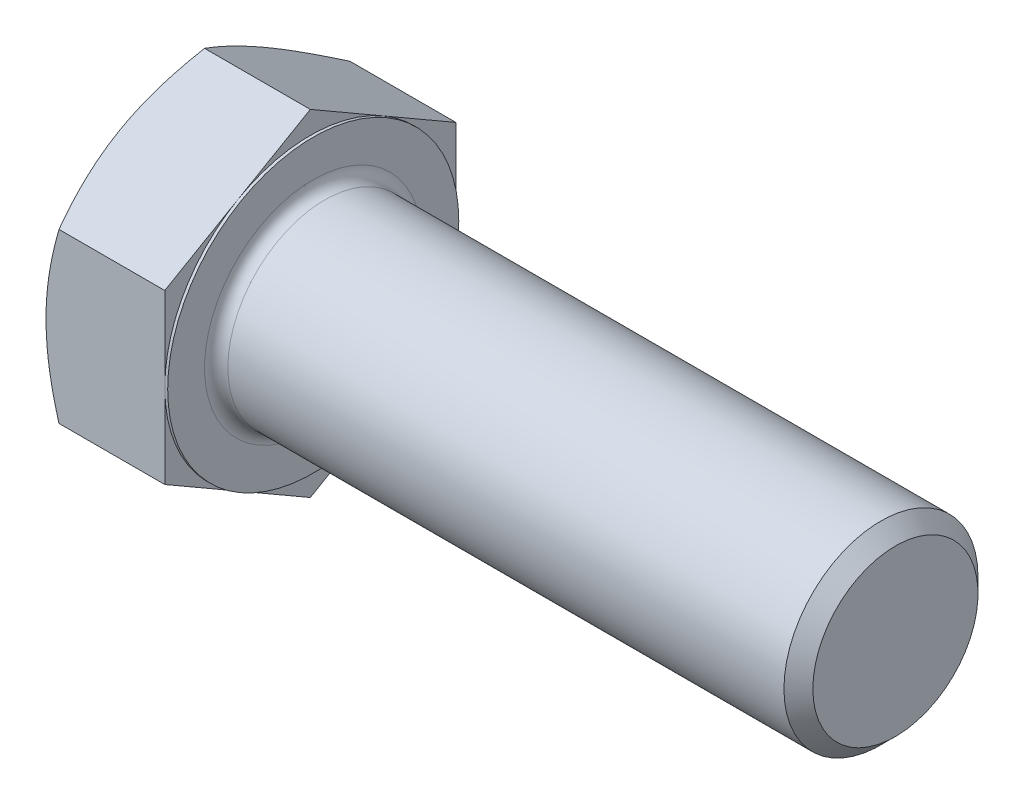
SolidWorks part; units mm, degrees
extrude "BaseHead" add sketch "Sketch1" along normal blind 15.9258
sketch "Sketch1" plane through (0, 0, 0) normal (1, 0, 0) x (0, 0, -1)
  line L0 (19.05, 10.9985) -> (19.05, -10.9985)
  line L1 (-19.05, 10.9985) -> (-19.05, -10.9985)
  line L2 (19.05, -10.9985) -> (0, -21.997)
  line L3 (0, -21.997) -> (-19.05, -10.9985)
  line L4 (19.05, 10.9985) -> (0, 21.997)
  line L5 (0, 21.997) -> (-19.05, 10.9985)
revolve "HeadChamfer" cut sketch "Sketch3" angle 360 about L6
sketch "Sketch3" plane through (0, 0, 0) normal (0, 0, 1) x (1, 0, 0)
  line L0 (0, 19.05) -> (5.3677, 28.347)
  line L1 (0, 21.997) -> (0, 10.9985) construction
  line L2 (5.3677, 28.347) -> (5.3677, 34.697)
  line L3 (5.3677, 34.697) -> (-12.7, 34.697)
  line L4 (-12.7, 34.697) -> (-12.7, 19.05)
  line L5 (-12.7, 19.05) -> (0, 19.05)
  line L6 (0, 0) -> (99.06, 0) construction
  line L7 (15.9258, 21.997) -> (0, 21.997) construction
ref_plane "Plane1" through (0, 0, 0) normal (0, 0, 1) x (1, 0, 0)
ref_plane "Plane2" through (0, 0, 0) normal (0, 1, 0) x (1, 0, 0)
ref_plane "Plane3" through (0, 0, 0) normal (1, 0, 0) x (0, 0, -1)
other "Configuration Table"
sketch "BodySke" plane through (0, 0, 0) normal (0, 0, 1) x (1, 0, 0)
  line L0 (0, 10.9985) -> (0, -10.9985) construction
  line L1 (0, 0) -> (92.1258, 0)
  line L2 (0, 0) -> (0, 12.7)
  line L3 (0, 12.7) -> (90.2335, 12.7)
  line L4 (92.1258, 0) -> (92.1258, 10.8077)
  line L5 (15.9258, 21.997) -> (15.9258, 10.9985) construction
  line L6 (92.1258, 10.8077) -> (90.2335, 12.7)
  line L7 (0, 0) -> (96.52, 0) construction
  line L8 (92.1258, -10.8077) -> (90.2335, -12.7) construction
  line L9 (0, -12.7) -> (90.2335, -12.7) construction
  line L10 (18.034, 15.24) -> (18.034, -1.27) construction
  line L11 (60.3758, 15.24) -> (60.3758, -1.27) construction
  line L12 (15.9258, 10.9985) -> (15.9258, -10.9985) construction
revolve "BaseBody" add sketch "BodySke" angle 360 about L7
sketch "Sketch4" plane through (0, 0, 0) normal (0, 0, 1) x (1, 0, 0)
  line L1 (15.9258, 21.997) -> (15.9258, 10.9985) construction
  line L2 (15.9258, 19.05) -> (15.5448, 19.05)
  line L3 (15.9258, 19.05) -> (15.9258, 47.397)
  line L4 (15.9258, 47.397) -> (15.5448, 47.397)
  line L5 (0, 0) -> (95.25, 0) construction
  line L6 (0, 0) -> (96.52, 0) construction
  line L7 (15.5448, 19.05) -> (15.5448, 47.397)
  line L8 (15.9258, 21.997) -> (1.7015, 21.997) construction
revolve "BearingFace" cut sketch "Sketch4" angle 360 about L5
fillet "HeadFillet" radius 1.524 1 edges at (15.9258, 0, -12.7)
sketch "ThdSchSke" plane through (0, 0, 0) normal (0, 0, 1) x (1, 0, 0)
  line L0 (60.3758, -10.8077) -> (59.0508, -12.7)
  line L1 (60.3758, -10.8077) -> (61.7008, -12.7)
  line L2 (61.7008, -12.7) -> (61.7008, -15.875)
  line L3 (-3.175, 0) -> (5.1513, 0) construction
  line L5 (61.7008, -15.875) -> (59.0508, -15.875)
  line L6 (59.0508, -15.875) -> (59.0508, -12.7)
revolve "ThreadSchematic" [suppressed] cut sketch "ThdSchSke" angle 360 about L3
pattern_linear "ThdSchPat" [suppressed]
equation "\"D3@Sketch1\" = \"Width_flats@Sketch1\" / 2"
equation "\"D4@Sketch1\" = \"D3@Sketch1\""
equation "\"D5@Sketch1\" = \"D4@Sketch1\""
equation "\"Thread_minor@ThreadCosmetic\" = \"Minor_dia@BodySke\""
equation "\"D1@Sketch3\" = \"Width_flats@Sketch1\" / 2"
equation "\"D1@Sketch4\" = \"Width_flats@Sketch1\" / 2"
equation "\"Thread_length@ThreadCosmetic\" = ((sgn( (\"Length@BodySke\" - \"Advance@BodySke\" ) - \"Thread_nom@BodySke\" )-1)*( (\"Length@BodySke\" - \"Advance@BodySke\" ) - \"Thread_nom@BodySke\" ))/-2+ \"Thread_nom@BodySke\""
equation "\"Thread_minor@ThdSchSke\" = \"Minor_dia@BodySke\""
equation "\"Diameter@ThdSchSke\" = \"Diameter@BodySke\""
equation "\"Overcut@ThdSchSke\" = \"Diameter@BodySke\" * 1.25"
equation "\"Start@ThdSchSke\" = \"Head_ht@BaseHead\" + \"Length@BodySke\" - \"Thread_length@ThreadCosmetic\"  '---Non-countersunk---"
equation "\"Num_threads@ThdSchPat\" = int( \"Thread_length@ThreadCosmetic\" / \"Advance@BodySke\" + 0.999 )  + 1"
equation "\"Advance@ThdSchPat\" = \"Thread_length@ThreadCosmetic\" /  (\"Num_threads@ThdSchPat\" - 1) 'relax it"
equation "\"Num_threads@ThdSchPat\" = \"Num_threads@ThdSchPat\" - sgn( \"Num_threads@ThdSchPat\" - 1) '---chamfered tips only---"
